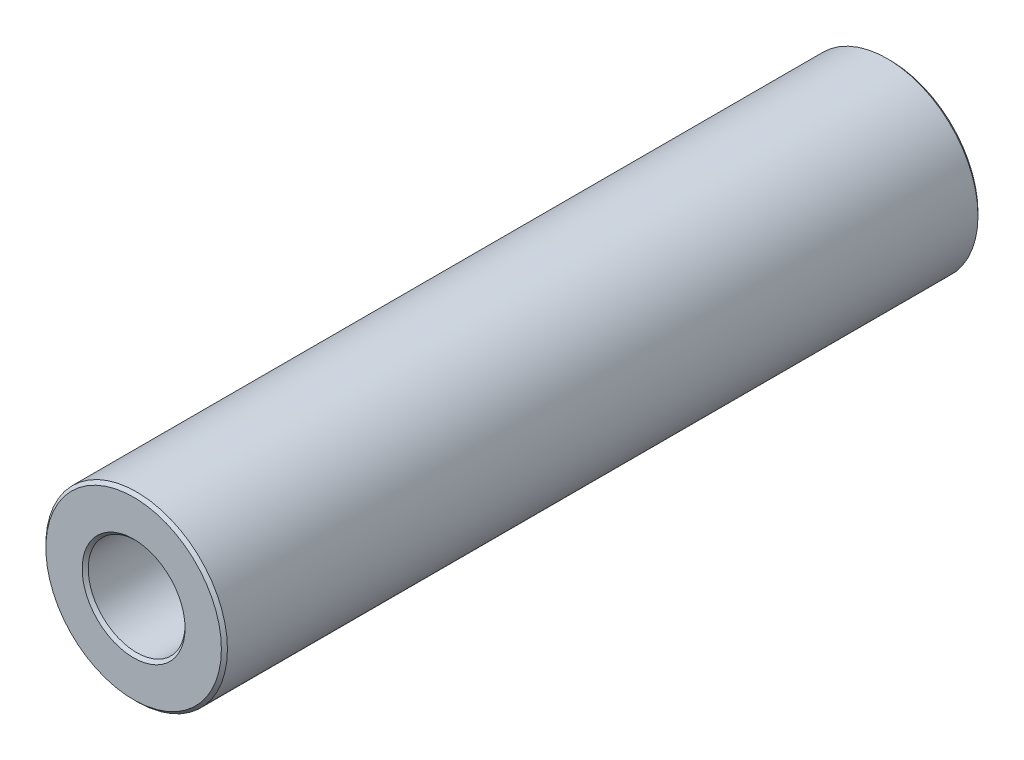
SolidWorks part; units mm, degrees
ref_plane "Front Plane" through (0, 0, 0) normal (0, 0, 1) x (1, 0, 0)
ref_plane "Top Plane" through (0, 0, 0) normal (0, 1, 0) x (1, 0, 0)
ref_plane "Right Plane" through (0, 0, 0) normal (1, 0, 0) x (0, 0, -1)
sketch "Sketch1" plane through (0, 0, 0) normal (0, 0, 1) x (1, 0, 0)
  circle A0 centre (0, 0) radius 3
  circle A1 centre (0, 0) radius 1.6
  dimension "D1" = 6
  dimension "D2" = 3.2
extrude "Boss-Extrude2" add sketch "Sketch1" along normal mid plane 25
chamfer "Chamfer3" distance 0.1 angle 45 4 edges at (3, 0, 12.5) (3, 0, -12.5) (1.6, 0, -12.5) (1.6, 0, 12.5)
